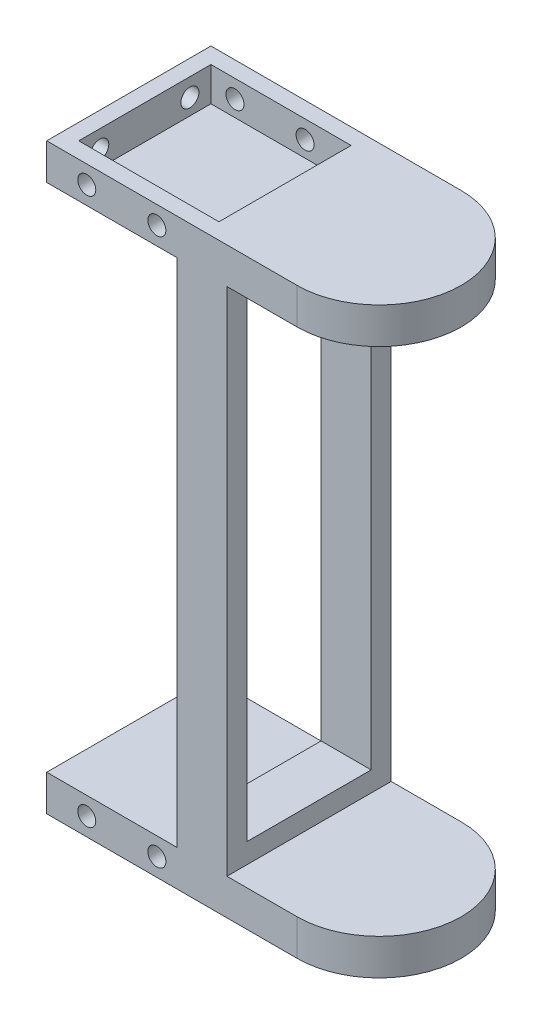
SolidWorks part; units mm, degrees
ref_plane "Ebene vorne" through (0, 0, 0) normal (0, 0, 1) x (1, 0, 0)
ref_plane "Ebene oben" through (0, 0, 0) normal (0, 1, 0) x (1, 0, 0)
ref_plane "Ebene rechts" through (0, 0, 0) normal (1, 0, 0) x (0, 0, -1)
sketch "Skizze1" plane through (0, 0, 0) normal (0, 1, 0) x (1, 0, 0)
  line L0 (0, 41) -> (0, -41) construction
  line L1 (-63.5, 41) -> (61.5, 41)
  line L2 (-63.5, 41) -> (-63.5, -41)
  line L3 (-63.5, -41) -> (61.5, -41)
  line L4 (61.5, 41) -> (61.5, -41) construction
  line L5 (0, 0) -> (-63.5, 0) construction
  arc A0 (61.5, -41) -> (61.5, 41) centre (61.5, 0) ccw
  point P7 (61.5, 0)
  dimension "D1" = 125
  dimension "D2" = 82
  dimension "D3" = 61.5
extrude "Linear austragen1" add sketch "Skizze1" along normal mid plane 291
sketch "Skizze2" plane through (0, 0, 41) normal (0, 0, 1) x (1, 0, 0)
  line L0 (102.5, -145.5) -> (102.5, 145.5) construction
  line L1 (102.5, 127.5) -> (26.5, 127.5)
  line L2 (102.5, 127.5) -> (102.5, -127.5)
  line L3 (102.5, -127.5) -> (26.5, -127.5)
  line L4 (26.5, 127.5) -> (26.5, -127.5)
  line L5 (-63.5, 145.5) -> (-63.5, -145.5) construction
  line L6 (-63.5, 127.5) -> (1.5, 127.5)
  line L7 (-63.5, 127.5) -> (-63.5, -127.5)
  line L8 (-63.5, -127.5) -> (1.5, -127.5)
  line L9 (1.5, 127.5) -> (1.5, -127.5)
  point P12 (1.5, 0)
  dimension "D1" = 65
  dimension "D2" = 255
  dimension "D3" = 25
extrude "Schnitt-Linear austragen1" cut sketch "Skizze2" against normal through all
sketch "Skizze3" plane through (0, -145.5, 0) normal (0, -1, 0) x (1, 0, 0)
  line L0 (-63.5, -41) -> (-63.5, 41) construction
  line L1 (-55.5, 33) -> (14.5, 33)
  line L2 (-55.5, 33) -> (-55.5, -33)
  line L3 (-55.5, -33) -> (14.5, -33)
  line L4 (14.5, 33) -> (14.5, -33)
  line L5 (-63.5, 41) -> (61.5, 41) construction
  point P7 (-55.5, 0)
  dimension "D1" = 8
  dimension "D2" = 8
  dimension "D3" = 70
extrude "Schnitt-Linear austragen2" cut sketch "Skizze3" against normal offset from surface (17 mm away) 1
mirror "Spiegeln1" about plane through (0, 0, 0) normal (0, 1, 0) of "Schnitt-Linear austragen2"
sketch "Skizze4" plane through (0, 0, 41) normal (0, 0, 1) x (1, 0, 0)
  line L0 (0, 0) -> (-85.4449, 0) construction
  line L2 (-63.5, 145.5) -> (-63.5, 127.5) construction
  circle A0 centre (-43.5, 136.5) radius 4.5
  circle A1 centre (-8.5, 136.5) radius 4.5
  circle A2 centre (-8.5, -136.5) radius 4.5
  circle A3 centre (-43.5, -136.5) radius 4.5
  dimension "D1" = 9
  dimension "D2" = 273
  dimension "D3" = 35
  dimension "D4" = 20
extrude "Schnitt-Linear austragen3" cut sketch "Skizze4" against normal through all
sketch "Skizze5" plane through (-63.5, 0, 0) normal (-1, 0, 0) x (0, 0, 1)
  line L0 (0, 0) -> (0, 145.5) construction
  line L1 (-41, 145.5) -> (41, 145.5) construction
  line L2 (0, 0) -> (-41, 0) construction
  line L3 (-41, -127.5) -> (-41, 127.5) construction
  circle A0 centre (-22.5, 136.5) radius 4.5
  circle A1 centre (22.5, 136.5) radius 4.5
  circle A2 centre (22.5, -136.5) radius 4.5
  circle A3 centre (-22.5, -136.5) radius 4.5
  dimension "D1" = 9
  dimension "D2" = 273
  dimension "D3" = 45
extrude "Schnitt-Linear austragen4" cut sketch "Skizze5" against normal up to next
sketch "Skizze6" plane through (1.5, 0, 0) normal (-1, 0, 0) x (0, 0, 1)
  line L0 (-31, 0) -> (0, 0) construction
  line L1 (-31, 117.5) -> (31, 117.5)
  line L2 (-31, 117.5) -> (-31, -117.5)
  line L3 (-31, -117.5) -> (31, -117.5)
  line L4 (31, 117.5) -> (31, -117.5)
  line L5 (0, 117.5) -> (0, 0) construction
  line L6 (-41, 127.5) -> (41, 127.5) construction
  line L7 (-41, -127.5) -> (-41, 127.5) construction
  dimension "D1" = 10
  dimension "D2" = 10
extrude "Schnitt-Linear austragen5" cut sketch "Skizze6" against normal through all
